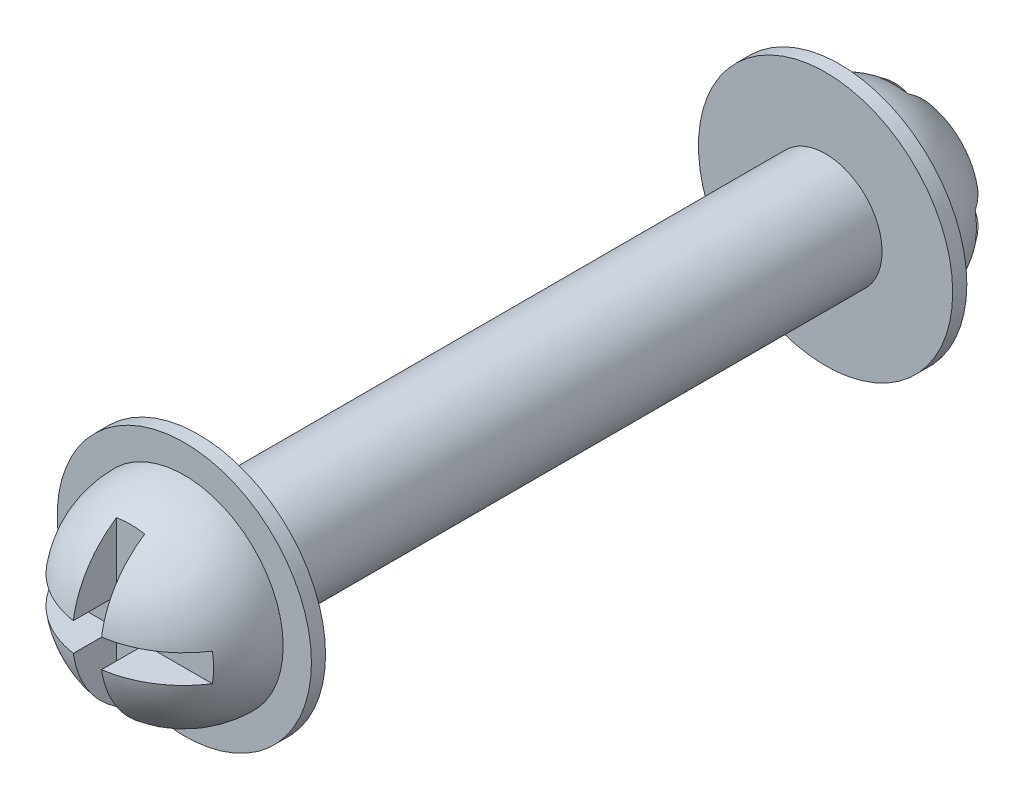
SolidWorks part; units mm, degrees
ref_plane "Front Plane" through (0, 0, 0) normal (0, 0, 1) x (1, 0, 0)
ref_plane "Top Plane" through (0, 0, 0) normal (0, 1, 0) x (1, 0, 0)
ref_plane "Right Plane" through (0, 0, 0) normal (1, 0, 0) x (0, 0, -1)
sketch "Sketch1" plane through (0, 0, 0) normal (1, 0, 0) x (0, 0, -1)
  line L0 (-35.2425, 6.35) -> (-35.2425, 14.2875)
  line L1 (-35.2425, 6.35) -> (35.2425, 6.35)
  line L2 (-77.1786, 0) -> (81.0028, 0) construction
  line L3 (36.83, 14.2875) -> (35.2425, 14.2875)
  line L4 (-47.9425, 0) -> (-47.9425, -11.2467) construction
  line L5 (0, 0) -> (0, 20.5642) construction
  line L7 (35.2425, 6.35) -> (35.2425, 14.2875)
  line L8 (-47.9425, 0) -> (47.9425, 0)
  line L9 (-36.83, 11.1125) -> (-36.83, 14.2875)
  line L10 (-36.83, 14.2875) -> (-35.2425, 14.2875)
  line L11 (36.83, 11.1125) -> (36.83, 14.2875)
  arc A0 (36.83, 11.1125) -> (47.9425, 0) centre (36.83, 0) cw
  arc A2 (-36.83, 11.1125) -> (-47.9425, 0) centre (-36.83, 0) ccw
  dimension "D2" = 70.485
  dimension "D4" = 95.885
  dimension "D1" = 12.7
  dimension "D3" = 28.575
  dimension "D5" = 1.5875
revolve "Revolve1" add sketch "Sketch1" angle 360 about L2
sketch "Sketch2" plane through (0, 0, 0) normal (1, 0, 0) x (0, 0, -1)
  line L0 (0, 0) -> (0, 18.0836) construction
  line L1 (-49.2125, 1.5875) -> (-42.8625, 1.5875)
  line L2 (-49.2125, 1.5875) -> (-49.2125, -1.5875)
  line L3 (-49.2125, -1.5875) -> (-42.8625, -1.5875)
  line L4 (-42.8625, 1.5875) -> (-42.8625, -1.5875)
  line L5 (0, 0) -> (-42.8625, 0) construction
  line L7 (42.8625, 1.5875) -> (42.8625, -1.5875)
  line L8 (49.2125, -1.5875) -> (42.8625, -1.5875)
  line L9 (49.2125, 1.5875) -> (49.2125, -1.5875)
  line L10 (49.2125, 1.5875) -> (42.8625, 1.5875)
  line L11 (-35.2425, -14.2875) -> (-35.2425, 14.2875) construction
  dimension "D1" = 3.175
  dimension "D2" = 6.35
  dimension "D3" = 7.62
extrude "Cut-Extrude1" cut sketch "Sketch2" against normal through all both and the other way through all
sketch "Sketch3" plane through (0.0527, 0, -0.0149) normal (0, 1, 0) x (0, 0, -1)
  line L0 (-0.0149, 0.0527) -> (-0.0149, 18.6125) construction
  line L1 (-50.4974, 1.6402) -> (-42.8774, 1.6402)
  line L2 (-50.4974, 1.6402) -> (-50.4974, -1.5348)
  line L3 (-50.4974, -1.5348) -> (-42.8774, -1.5348)
  line L4 (-42.8774, 1.6402) -> (-42.8774, -1.5348)
  line L5 (-0.0149, 0.0527) -> (-42.8774, 0.0527) construction
  line L7 (42.8476, 1.6402) -> (42.8476, -1.5348)
  line L8 (50.4676, -1.5348) -> (42.8476, -1.5348)
  line L9 (50.4676, 1.6402) -> (50.4676, -1.5348)
  line L10 (50.4676, 1.6402) -> (42.8476, 1.6402)
  line L11 (-42.8774, 9.2492) -> (-42.8774, -9.1439) construction
  dimension "D1" = 3.175
  dimension "D2" = 7.62
extrude "Cut-Extrude2" cut sketch "Sketch3" against normal through all both and the other way through all
